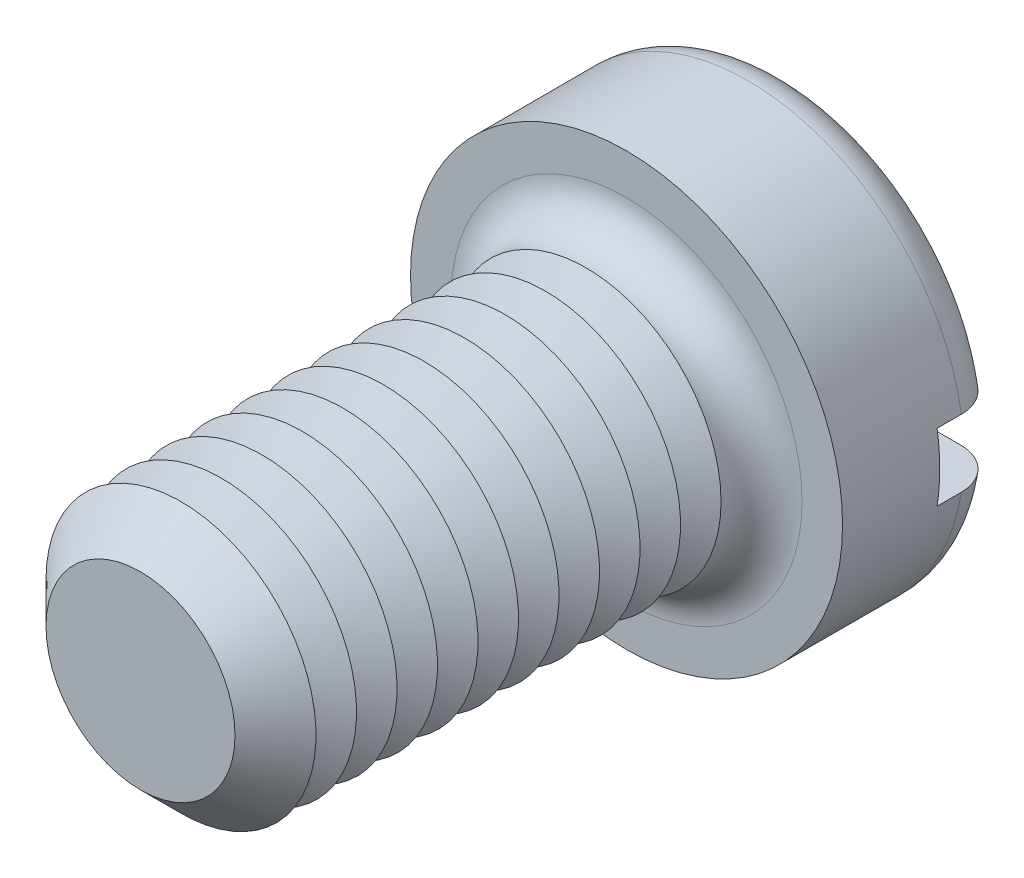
SolidWorks part; units mm, degrees
ref_plane "Front Plane" through (0, 0, 0) normal (0, 0, 1) x (1, 0, 0)
ref_plane "Top Plane" through (0, 0, 0) normal (0, 1, 0) x (1, 0, 0)
ref_plane "Right Plane" through (0, 0, 0) normal (1, 0, 0) x (0, 0, -1)
sketch "Sketch3" plane through (0, 0, 0) normal (0, 0, 1) x (1, 0, 0)
  circle A0 centre (0, 0) radius 8
  dimension "D1" = 16
extrude "Boss-Extrude2" add sketch "Sketch3" against normal blind 6
sketch "Sketch4" plane through (0, 0, 0) normal (0, 0, 1) x (1, 0, 0)
  circle A0 centre (0, 0) radius 5
  dimension "D1" = 10
extrude "Boss-Extrude3" add sketch "Sketch4" along normal blind 18
fillet "Fillet1" radius 1.5 2 edges at (8, 0, -6) (5, 0, 0)
chamfer "Chamfer1" distance 1.5 angle 45 1 edges at (5, 0, 18)
sketch "Sketch5" plane through (0, 0, 0) normal (1, 0, 0) x (0, 0, -1)
  line L0 (1.6944, 0) -> (-7.6738, 0) construction
sketch "Sketch6" plane through (0, 0, 0) normal (1, 0, 0) x (0, 0, -1)
  line L0 (-1.5, 5) -> (-2.25, 3.701)
  line L1 (-2.25, 3.701) -> (-3, 5)
  line L2 (-1.5, 5) -> (-16.5, 5) construction
  line L3 (-3, 5) -> (-1.5, 5)
  dimension "D1" = 1.5
revolve "Cut-Revolve1" cut sketch "Sketch6" angle 360 about L0
pattern_linear "LPattern1" count 10 spacing 1.5 along (0, 0, 1) of "Cut-Revolve1"
sketch "Sketch8" plane through (0, 0, -6) normal (0, 0, -1) x (-1, 0, 0)
  line L1 (8, -1.25) -> (-8, -1.25)
  line L2 (8, -1.25) -> (8, 1.25)
  line L3 (8, 1.25) -> (-8, 1.25)
  line L4 (-8, -1.25) -> (-8, 1.25)
  line L5 (8, -1.25) -> (-8, 1.25) construction
  line L6 (8, 1.25) -> (-8, -1.25) construction
  point P0 (0, 0)
  dimension "D1" = 16
  dimension "D2" = 2.5
extrude "Cut-Extrude1" cut sketch "Sketch8" against normal blind 2.4
